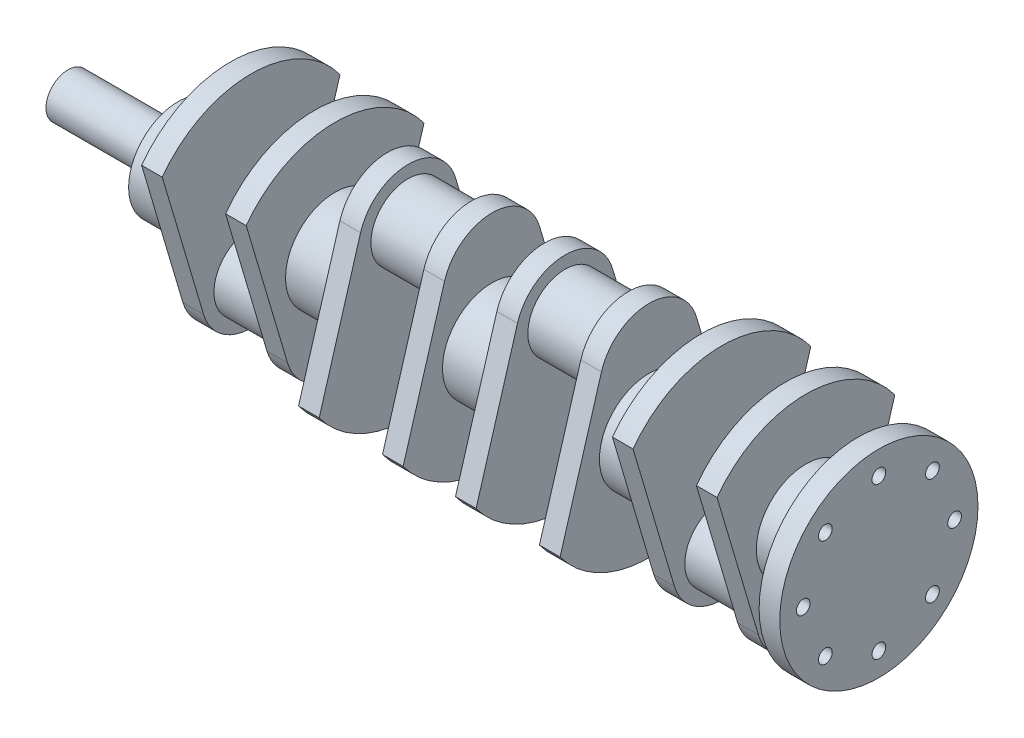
SolidWorks part; units mm, degrees
ref_plane "Ön Düzlem" through (0, 0, 0) normal (0, 0, 1) x (1, 0, 0)
ref_plane "Üst Düzlem" through (0, 0, 0) normal (0, 1, 0) x (1, 0, 0)
ref_plane "Sağ Düzlem" through (0, 0, 0) normal (1, 0, 0) x (0, 0, -1)
sketch "Sketch4" plane through (0, 0, 0) normal (0, 0, 1) x (1, 0, 0)
  line L0 (0, 0) -> (51412.2374, 0) construction
  line L1 (0, 0) -> (0, 72)
  line L2 (0, 72) -> (-15, 72)
  line L3 (-15, 72) -> (-15, 36)
  line L4 (-15, 36) -> (-53, 36)
  line L5 (-53, 36) -> (-53, 0)
  line L7 (-15, 36) -> (-15, 0)
  line L8 (-15, 0) -> (-53, 0)
  line L9 (-15, 0) -> (0, 0)
  line L10 (-129, 36) -> (-167, 36)
  line L11 (-167, 36) -> (-167, 0)
  line L12 (-129, 0) -> (-167, 0)
  line L13 (-129, 36) -> (-129, 0)
  line L14 (-243, 36) -> (-281, 36)
  line L15 (-281, 36) -> (-281, 0)
  line L16 (-243, 0) -> (-281, 0)
  line L17 (-243, 36) -> (-243, 0)
  line L18 (-357, 36) -> (-395, 36)
  line L19 (-395, 36) -> (-395, 0)
  line L20 (-357, 0) -> (-395, 0)
  line L21 (-357, 36) -> (-357, 0)
  line L22 (-471, 36) -> (-509, 36)
  line L23 (-509, 36) -> (-509, 19)
  line L24 (-471, 0) -> (-509, 0)
  line L25 (-471, 36) -> (-471, 0)
  line L26 (-512, 16) -> (-589, 16)
  line L27 (-589, 16) -> (-589, 0)
  line L28 (-589, 0) -> (-509, 0)
  arc A0 (-509, 19) -> (-512, 16) centre (-512, 19) cw
  dimension "D8" = 3
  dimension "D1" = 72
  dimension "D2" = 15
  dimension "D3" = 36
  dimension "D4" = 38
  dimension "D5" = 5
  dimension "D6" = 76
  dimension "D7" = 16
revolve "Revolve1" add sketch "Sketch4" angle 360 about L0
sketch "Sketch5" plane through (-471, 0, 0) normal (1, 0, 0) x (0, 0, -1)
  line L0 (-64.5699, 47.2306) -> (-34.5175, -54.2246)
  line L2 (64.5699, 47.2306) -> (34.5175, -54.2246)
  line L3 (0, 80) -> (0, -80) construction
  circle A0 centre (0, -44) radius 36
  arc A1 (-64.5699, 47.2306) -> (64.5699, 47.2306) centre (0, 0) cw
  point P2 (0, 80)
  dimension "D1" = 72
  dimension "D2" = 80
  dimension "D3" = 44
  dimension "D4" = 33
extrude "Boss-Extrude3" add sketch "Sketch5" along normal blind 15 contours L3 A1 L0 A0 M5 | A1 L3 A0 L2 M5 | L3 A0 M5 | L3 A0 M5 | L3 A0 M5 | A0 L3 M5 | L3 A0 M5 | L3 A0 M5
sketch "Sketch6" plane through (-456, 0, 0) normal (1, 0, 0) x (0, 0, -1)
  arc A0 (-34.5175, -54.2246) -> (34.5175, -54.2246) centre (0, -44) ccw construction
  arc A1 (-34.5175, -54.2246) -> (34.5175, -54.2246) centre (0, -44) ccw construction
  circle A2 centre (0, -44) radius 27
  dimension "D1" = 54
extrude "Boss-Extrude4" add sketch "Sketch6" along normal blind 46
pattern_linear "LPattern2" count 2 spacing 61 along (1, 0, 0) of "Boss-Extrude3"
pattern_linear "LPattern3" count 2 spacing 342 along (1, 0, 0) of "Boss-Extrude3", "Boss-Extrude4", "LPattern2"
sketch "Sketch7" plane through (-357, 0, 0) normal (1, 0, 0) x (0, 0, -1)
  line L0 (64.5699, -47.2306) -> (34.5175, 54.2246)
  line L1 (-64.5699, -47.2306) -> (-34.5175, 54.2246)
  line L2 (0, -80) -> (0, 80) construction
  circle A0 centre (0, 44) radius 36
  arc A1 (64.5699, -47.2306) -> (-64.5699, -47.2306) centre (0, 0) cw
  arc A2 (64.5699, 47.2306) -> (-64.5699, 47.2306) centre (0, 0) ccw construction
  point P2 (0, -80)
  dimension "D1" = 72
  dimension "D2" = 80
  dimension "D3" = 44
  dimension "D4" = 33
extrude "Boss-Extrude5" add sketch "Sketch7" along normal blind 15 contours L2 A0 M2 | L2 A0 M2 | L2 A0 M2 | A0 L2 M2 | L2 A0 M2 | L2 A0 M2 | L2 A1 L0 A0 M2 | A1 L2 A0 L1 M2
sketch "Sketch8" plane through (-342, 0, 0) normal (1, 0, 0) x (0, 0, -1)
  arc A0 (34.5175, 54.2246) -> (-34.5175, 54.2246) centre (0, 44) ccw construction
  arc A1 (34.5175, 54.2246) -> (-34.5175, 54.2246) centre (0, 44) ccw construction
  circle A2 centre (0, 44) radius 27
  dimension "D1" = 54
extrude "Boss-Extrude6" add sketch "Sketch8" along normal blind 46
pattern_linear "LPattern4" count 2 spacing 61 along (1, 0, 0) of "Boss-Extrude5"
pattern_linear "LPattern5" count 2 spacing 114 along (1, 0, 0) of "Boss-Extrude6", "LPattern4", "Boss-Extrude5"
sketch "Sketch9" plane through (0, 0, 0) normal (1, 0, 0) x (0, 0, -1)
  circle A0 centre (0, 0) radius 55 construction
  circle A1 centre (0, 55) radius 5
  circle A2 centre (38.8909, 38.8909) radius 5
  circle A3 centre (55, 0) radius 5
  circle A4 centre (38.8909, -38.8909) radius 5
  circle A5 centre (0, -55) radius 5
  circle A6 centre (-38.8909, -38.8909) radius 5
  circle A7 centre (-55, 0) radius 5
  circle A8 centre (-38.8909, 38.8909) radius 5
  point P9 (0, 0)
  dimension "D1" = 110
  dimension "D2" = 10
  dimension "D3" = 8
extrude "Cut-Extrude1" cut sketch "Sketch9" against normal up to next and the other way through all
